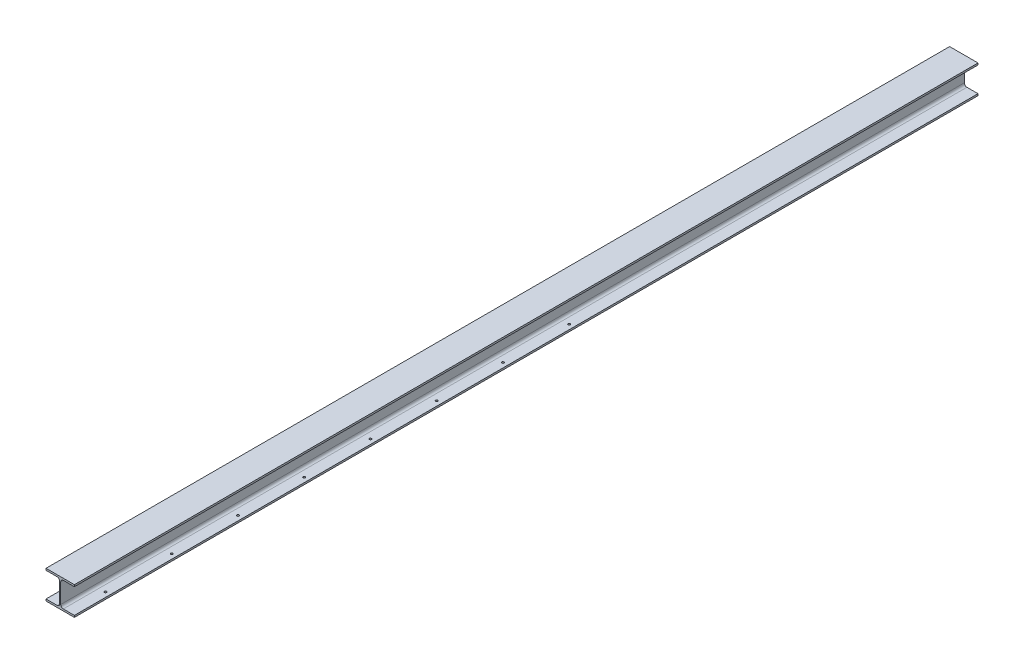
SolidWorks part; units mm, degrees
ref_plane "Vorderansicht" through (0, 0, 0) normal (0, 0, 1) x (1, 0, 0)
ref_plane "Draufsicht" through (0, 0, 0) normal (0, 1, 0) x (1, 0, 0)
ref_plane "Seitenansicht" through (0, 0, 0) normal (1, 0, 0) x (0, 0, -1)
sketch "Sketch1" plane through (0, 0, 0) normal (0, 0, 1) x (1, 0, 0)
  line L0 (0, 100) -> (0, -90) construction
  line L1 (-150, 0) -> (150, 0)
  line L2 (150, 0) -> (150, 19)
  line L3 (-150, 0) -> (-150, 19)
  line L4 (150, 19) -> (32.5, 19)
  line L5 (-150, 19) -> (-32.5, 19)
  line L6 (5.5, 46) -> (5.5, 254)
  line L7 (-5.5, 46) -> (-5.5, 254)
  line L8 (32.5, 281) -> (150, 281)
  line L9 (-32.5, 281) -> (-150, 281)
  line L10 (150, 281) -> (150, 300)
  line L11 (-150, 281) -> (-150, 300)
  line L12 (150, 300) -> (-150, 300)
  arc A0 (32.5, 281) -> (5.5, 254) centre (32.5, 254) ccw
  arc A1 (-5.5, 254) -> (-32.5, 281) centre (-32.5, 254) ccw
  arc A2 (32.5, 19) -> (5.5, 46) centre (32.5, 46) cw
  arc A3 (-32.5, 19) -> (-5.5, 46) centre (-32.5, 46) ccw
  point P6 (0, 0)
  point P16 (0, 300)
  dimension "D5" = 27
  dimension "D6" = 27
  dimension "r1" = 27
  dimension "D8" = 27
  dimension "h" = 300
  dimension "b" = 300
  dimension "t" = 19
  dimension "s" = 11
extrude "Extrude1" add sketch "Sketch1" along normal mid plane 9550
sketch "Sketch2" plane through (0, 0, 0) normal (0, -1, 0) x (1, 0, 0)
  line L0 (-150, 4775) -> (150, 4775) construction
  line L1 (-150, 4775) -> (-150, -4775) construction
  circle A1 centre (-100, 4645.9981) radius 11
  dimension "D2" = 22
  dimension "D3" = 50
  dimension "D1" = 129.0019
extrude "Cut-Extrude1" cut sketch "Sketch2" against normal up to next
pattern_linear "LPattern1" count 2 spacing 250 along (0, 0, -1) count 2 spacing 200 along (1, 0, 0) of "Cut-Extrude1"
pattern_linear "LPattern2" count 8 spacing 700 along (0, 0, -1) of "LPattern1", "Cut-Extrude1"
